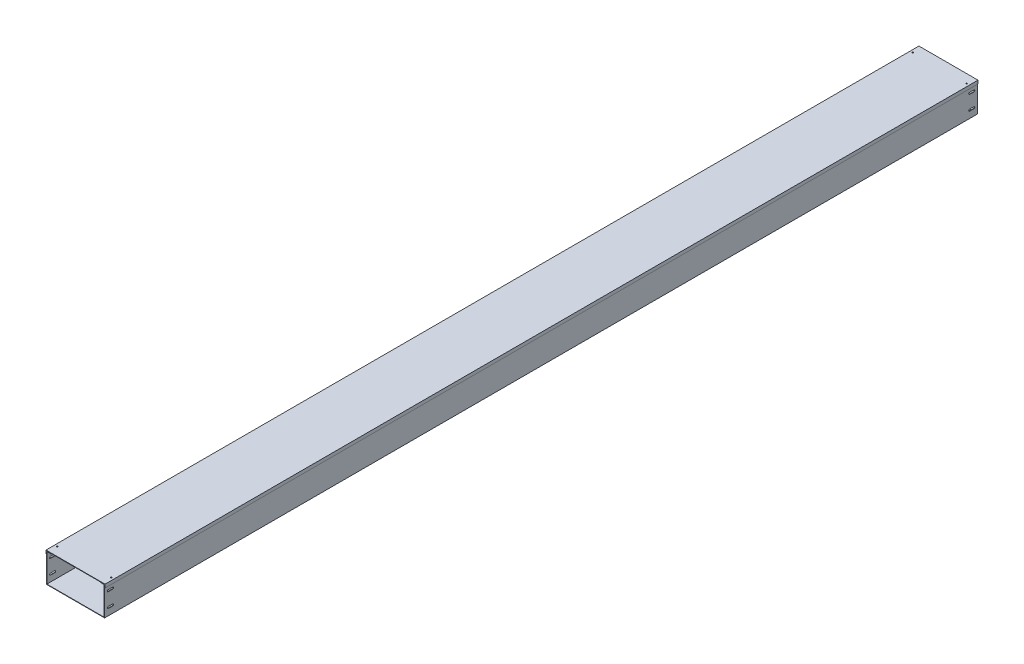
SolidWorks part; units mm, degrees
ref_plane "Front Plane" through (0, 0, 0) normal (0, 0, 1) x (1, 0, 0)
ref_plane "Top Plane" through (0, 0, 0) normal (0, 1, 0) x (1, 0, 0)
ref_plane "Right Plane" through (0, 0, 0) normal (1, 0, 0) x (0, 0, -1)
sketch "DuctSketch" plane through (0, 0, 0) normal (0, 0, 1) x (1, 0, 0)
  line L0 (-100, -50) -> (100, -50)
  line L1 (100, -50) -> (100, 50)
  line L2 (-100, -50) -> (-100, 50)
  line L3 (-100, 50) -> (-85, 50)
  line L4 (100, 50) -> (85, 50)
  line L5 (-100, 50) -> (100, -50) construction
  point P3 (0, 0)
  dimension "Height" = 100
  dimension "Width" = 200
  dimension "D1" = 15
extrude "Extrusion" add sketch "DuctSketch" along normal blind 3000 thin
sketch "FilterSketch" plane through (0, 0, 0) normal (0, 0, 1) x (1, 0, 0)
  line L1 (100, 100) -> (-100, 100)
  line L2 (100, 100) -> (100, 0)
  line L3 (100, 0) -> (-100, 0)
  line L4 (-100, 100) -> (-100, 0)
  dimension "NominalHeight" = 100
  dimension "NominalWidth" = 200
sketch "Sketch1" plane through (0, 0, 0) normal (1, 0, 0) x (0, 0, -1)
  line L0 (0, 0) -> (-40, 0) construction
  line L2 (-20, 0) -> (-20, -50) construction
  line L4 (-20, 0) -> (-20, 50) construction
  line L6 (-27.5, 25) -> (-12.5, 25) construction
  line L7 (-27.5, 28) -> (-12.5, 28)
  line L8 (-27.5, 22) -> (-12.5, 22)
  line L9 (-27.5, -25) -> (-12.5, -25) construction
  line L10 (-27.5, -22) -> (-12.5, -22)
  line L11 (-27.5, -28) -> (-12.5, -28)
  line L14 (0, -50) -> (0, 50) construction
  line L18 (-3000, -50) -> (0, -50) construction
  line L19 (-3000, 50) -> (0, 50) construction
  arc A0 (-27.5, 28) -> (-27.5, 22) centre (-27.5, 25) ccw
  arc A1 (-12.5, 22) -> (-12.5, 28) centre (-12.5, 25) ccw
  arc A2 (-27.5, -22) -> (-27.5, -28) centre (-27.5, -25) ccw
  arc A3 (-12.5, -28) -> (-12.5, -22) centre (-12.5, -25) ccw
  point P13 (-20, 25)
  point P19 (-20, -25)
  dimension "D1" = 3
  dimension "D2" = 15
  dimension "D5" = 40
extrude "Cut-Extrude1" cut sketch "Sketch1" against normal through all and the other way through all
sketch "Sketch2" plane through (0, 0, 0) normal (1, 0, 0) x (0, 0, -1)
  line L0 (-3000, 0) -> (-2960, 0) construction
  line L1 (-2980, 0) -> (-2980, 50) construction
  line L2 (-2980, 0) -> (-2980, -50) construction
  line L3 (-3000, -50) -> (-3000, 50) construction
  line L4 (-2987.5, 25) -> (-2972.5, 25) construction
  line L5 (-2987.5, 28) -> (-2972.5, 28)
  line L6 (-2987.5, 22) -> (-2972.5, 22)
  line L7 (-2987.5, -25) -> (-2972.5, -25) construction
  line L8 (-2987.5, -22) -> (-2972.5, -22)
  line L9 (-2987.5, -28) -> (-2972.5, -28)
  line L10 (-3000, 50) -> (0, 50) construction
  line L11 (-3000, -50) -> (0, -50) construction
  arc A0 (-2987.5, 28) -> (-2987.5, 22) centre (-2987.5, 25) ccw
  arc A1 (-2972.5, 22) -> (-2972.5, 28) centre (-2972.5, 25) ccw
  arc A2 (-2987.5, -22) -> (-2987.5, -28) centre (-2987.5, -25) ccw
  arc A3 (-2972.5, -28) -> (-2972.5, -22) centre (-2972.5, -25) ccw
  point P10 (-2980, 25)
  point P16 (-2980, -25)
  dimension "D5" = 3
  dimension "D1" = 40
  dimension "D4" = 15
extrude "Cut-Extrude2" cut sketch "Sketch2" against normal through all and the other way through all
sketch "Sketch3" plane through (0, 50, 0) normal (0, 1, 0) x (1, 0, 0)
  line L12 (-85, 0) -> (-100, 0) construction
  line L14 (92.5, 0) -> (92.5, -60) construction
  line L17 (-92.5, 0) -> (-92.5, -60) construction
  line L18 (100, 0) -> (85, 0) construction
  circle A0 centre (-92.5, -30) radius 2
  circle A1 centre (92.5, -30) radius 2
  dimension "D2" = 30
  dimension "D1" = 4
extrude "Cut-Extrude3" cut sketch "Sketch3" against normal up to next
sketch "Sketch4" plane through (0, 50, 0) normal (0, 1, 0) x (1, 0, 0)
  line L0 (-92.5, -3000) -> (-92.5, -2940) construction
  line L1 (-85, -3000) -> (-100, -3000) construction
  line L2 (92.5, -3000) -> (92.5, -2940) construction
  line L3 (100, -3000) -> (85, -3000) construction
  circle A0 centre (-92.5, -2970) radius 2
  circle A1 centre (92.5, -2970) radius 2
  dimension "D1" = 4
  dimension "D2" = 30
extrude "Cut-Extrude4" cut sketch "Sketch4" against normal up to next
sketch "Sketch5" plane through (0, 0, 0) normal (0, 0, 1) x (1, 0, 0)
  line L0 (-100, 40) -> (-100, 50)
  line L1 (-100, 50) -> (-100, -50) construction
  line L2 (-100, 50) -> (100, 50)
  line L3 (100, 50) -> (100, 40)
  line L4 (100, -50) -> (100, 50) construction
  dimension "D1" = 10
extrude "Extrude-Thin1" add sketch "Sketch5" along normal blind 3000 separate body thin
sketch "Sketch6" plane through (0, 51.5, 0) normal (0, -1, 0) x (1, 0, 0)
  circle A2 centre (92.5, 30) radius 2 construction
  circle A3 centre (92.5, 30) radius 2
  circle A6 centre (-92.5, 30) radius 2 construction
  circle A7 centre (-92.5, 30) radius 2
extrude "Cut-Extrude5" cut sketch "Sketch6" along normal up to next (1.5 mm away)
sketch "Sketch7" plane through (0, 51.5, 0) normal (0, 1, 0) x (1, 0, 0)
  circle A0 centre (-92.5, -2970) radius 2 construction
  circle A1 centre (92.5, -2970) radius 2 construction
  circle A2 centre (-92.5, -2970) radius 2
  circle A3 centre (92.5, -2970) radius 2
extrude "Cut-Extrude6" cut sketch "Sketch7" against normal up to next (1.5 mm away)
equation "\"Cut-Extrude1\"= IIF ( \"Length@Extrusion\" < = 50mm , \"suppressed\" , \"unsuppressed\" )"
equation "\"Cut-Extrude2\"= if ( \"Length@Extrusion\" < = 100mm , \"suppressed\" , \"unsuppressed\" )"
equation "\"Thickness@Extrude-Thin1\"=\"Thickness@Extrusion\""
equation "\"Length@Extrude-Thin1\"=\"Length@Extrusion\""
equation "\"Cut-Extrude3\"= IIF ( \"Length@Extrusion\" < = 50mm , \"suppressed\" , \"unsuppressed\" )"
equation "\"Cut-Extrude4\" = IIF ( \"Length@Extrusion\" < = 100mm , \"suppressed\" , \"unsuppressed\" )"
equation "\"Cut-Extrude5\"= IIF ( \"Length@Extrusion\" < = 50mm , \"suppressed\" , \"unsuppressed\" )"
equation "\"Cut-Extrude6\"= IIF ( \"Length@Extrusion\" < = 100mm , \"suppressed\" , \"unsuppressed\" )"
